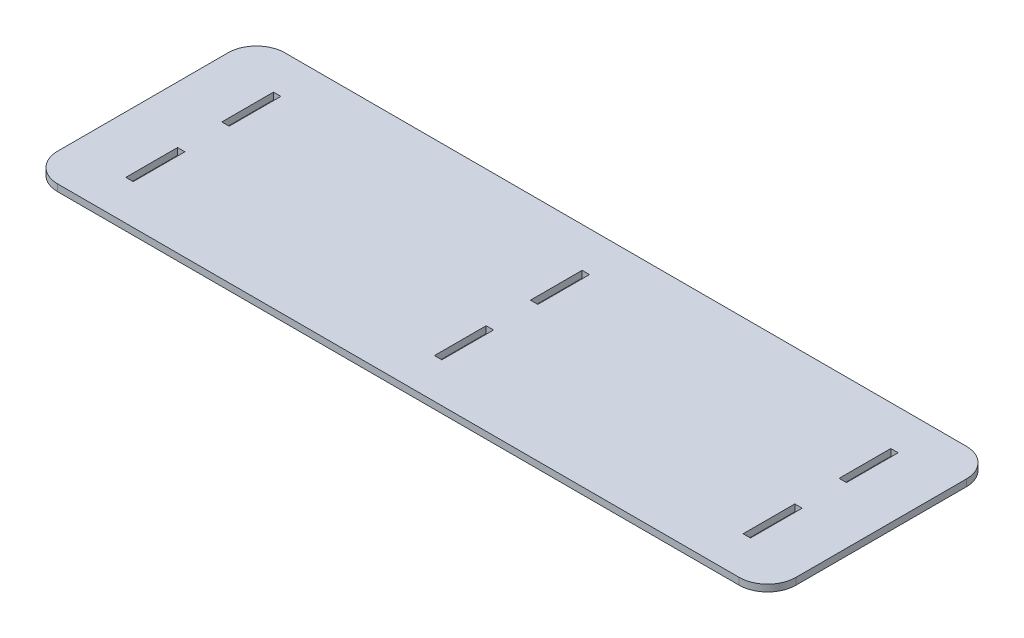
SolidWorks part; units mm, degrees
ref_plane "Front Plane" through (0, 0, 0) normal (0, 0, 1) x (1, 0, 0)
ref_plane "Top Plane" through (0, 0, 0) normal (0, 1, 0) x (1, 0, 0)
ref_plane "Right Plane" through (0, 0, 0) normal (1, 0, 0) x (0, 0, -1)
sketch "Sketch1" plane through (0, 0, 0) normal (0, 1, 0) x (1, 0, 0)
  line L0 (-650, 0) -> (650, 0) construction
  line L1 (-650, 200) -> (650, 200)
  line L2 (-650, 200) -> (-650, -200)
  line L3 (-650, -200) -> (650, -200)
  line L4 (650, 200) -> (650, -200)
  line L5 (-650, 200) -> (650, -200) construction
  line L6 (-650, -200) -> (650, 200) construction
  line L7 (-650, 130) -> (650, 130) construction
  line L8 (-650, -130) -> (650, -130) construction
  line L9 (-550, -130) -> (-550, -39)
  line L10 (-550, -39) -> (-537, -39)
  line L11 (-537, -39) -> (-537, -130)
  line L12 (-537, -130) -> (-550, -130)
  line L13 (-550, 130) -> (-537, 130)
  line L14 (-537, 130) -> (-537, 39)
  line L15 (-537, 39) -> (-550, 39)
  line L16 (-550, 39) -> (-550, 130)
  line L17 (0, 200) -> (0, -200) construction
  line L18 (537, -130) -> (550, -130)
  line L19 (537, -39) -> (537, -130)
  line L20 (550, -130) -> (550, -39)
  line L21 (550, -39) -> (537, -39)
  line L22 (537, 39) -> (550, 39)
  line L23 (537, 130) -> (537, 39)
  line L24 (550, 130) -> (537, 130)
  line L25 (550, 39) -> (550, 130)
  line L26 (-6.5, 130) -> (6.5, 130)
  line L27 (6.5, 130) -> (6.5, 39)
  line L28 (6.5, 39) -> (-6.5, 39)
  line L29 (-6.5, 39) -> (-6.5, 130)
  line L30 (6.5, -39) -> (-6.5, -39)
  line L31 (6.5, -130) -> (6.5, -39)
  line L32 (-6.5, -130) -> (6.5, -130)
  line L33 (-6.5, -39) -> (-6.5, -130)
  point P0 (0, 0)
  dimension "D1" = 1300
  dimension "D2" = 400
  dimension "D3" = 260
  dimension "D4" = 130
  dimension "D5" = 91
  dimension "D6" = 91
  dimension "D7" = 13
  dimension "D8" = 13
  dimension "D9" = 100
  dimension "D10" = 6.5
  dimension "D11" = 13
  dimension "D12" = 91
extrude "Boss-Extrude1" add sketch "Sketch1" along normal blind 12
fillet "Fillet2" radius 50 4 edges at (-650, 6, -200) (-650, 6, 200) (650, 6, 200) (650, 6, -200)
